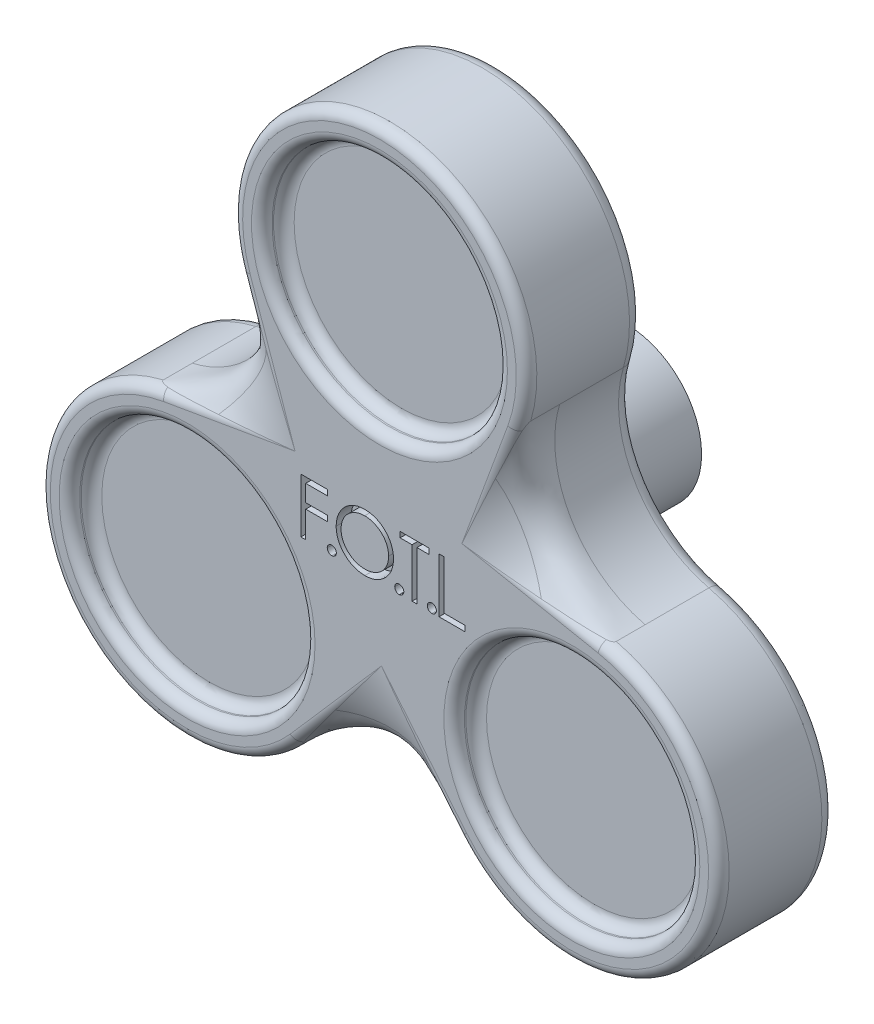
SolidWorks part; units mm, degrees
ref_plane "Front Plane" through (0, 0, 0) normal (0, 0, 1) x (1, 0, 0)
ref_plane "Top Plane" through (0, 0, 0) normal (0, 1, 0) x (1, 0, 0)
ref_plane "Right Plane" through (0, 0, 0) normal (1, 0, 0) x (0, 0, -1)
sketch "Sketch1" plane through (0, 0, 0) normal (0, 0, 1) x (1, 0, 0)
  circle A0 centre (0, 0) radius 2.55
  dimension "D1" = 5.1
extrude "Boss-Extrude1" add sketch "Sketch1" along normal blind 4.4
sketch "Sketch2" plane through (0, 0, 4.4) normal (0, 0, 1) x (1, 0, 0)
  line L0 (-4.7294, 5.9275) -> (-2.412, -0.8275)
  line L1 (4.6925, 5.8236) -> (2.55, 0)
  line L2 (7.4981, 1.1321) -> (0.4894, 2.5026)
  line L3 (2.6972, -6.9756) -> (-1.275, -2.2084)
  line L4 (-2.7686, -7.0595) -> (1.9226, -1.6751)
  line L5 (-7.3897, 1.152) -> (-1.275, 2.2084)
  arc A0 (-10.8686, -6.275) -> (10.8686, -6.275) centre (0, 0) ccw construction
  circle A1 centre (0, 0) radius 2.55 construction
  circle A2 centre (0, 0) radius 2.55
  arc A3 (4.6925, 5.8236) -> (-4.7294, 5.9275) centre (0, 7.55) ccw
  arc A4 (2.6972, -6.9756) -> (7.4981, 1.1321) centre (6.5385, -3.775) ccw
  arc A5 (-7.3897, 1.152) -> (-2.7686, -7.0595) centre (-6.5385, -3.775) ccw
  arc A6 (0, 12.55) -> (-10.8686, -6.275) centre (0, 0) ccw construction
  arc A7 (10.8686, -6.275) -> (0, 12.55) centre (0, 0) ccw construction
  point P24 (0, 0)
  dimension "D1" = 10
  dimension "D2" = 10
  dimension "D3" = 3
extrude "Boss-Extrude2" add sketch "Sketch2" along normal blind 4 contours L3 A4 L2 L1 L4 M2 | L1 L2 M2 | L5 L0 M2 | M2 | L3 L4 M2 | L5 A5 L4 L3 L0 M2 | L1 A3 L0 L5 L2 M2
sketch "Sketch3" plane through (0, 0, 8.4) normal (0, 0, 1) x (1, 0, 0)
  circle A0 centre (0, 7.55) radius 4
  circle A1 centre (6.5385, -3.775) radius 4
  circle A2 centre (-6.5385, -3.775) radius 4
  arc A3 (4.6925, 5.8236) -> (-4.7294, 5.9275) centre (0, 7.55) ccw construction
  dimension "D1" = 1
extrude "Cut-Extrude1" cut sketch "Sketch3" against normal blind 0.75
fillet "Fillet1" radius 0.35 15 edges at (4, 7.55, 7.65) (4, 7.55, 8.4) (1.3791, -5.3937, 8.4) (5.3843, 1.5454, 8.4) (-5.3606, 1.5025, 8.4) (-1.3538, -5.4357, 8.4) (3.9816, 3.8912, 8.4) (-4.0305, 3.8903, 8.4) (10.8408, -6.3226, 8.4) (-10.8959, -6.2271, 8.4) (0.0551, 12.5497, 8.4) (-2.5385, -3.775, 7.65) (-2.5385, -3.775, 8.4) (10.5385, -3.775, 7.65) (10.5385, -3.775, 8.4)
fillet "Fillet2" radius 4 6 edges at (3.1329, 1.8812, 8.2975) (3.2706, 1.9587, 6.225) (-3.1956, 1.7725, 8.2975) (0.0627, -3.6537, 8.2975) (-3.3316, 1.8531, 6.225) (0.061, -3.8118, 6.225)
fillet "Fillet3" radius 0.5 7 edges at (5.1611, 2.9798, 4.4) (10.8686, -6.275, 4.4) (0, -5.9595, 4.4) (-10.8686, -6.275, 4.4) (-5.1611, 2.9798, 4.4) (0, 12.55, 4.4) (2.55, 0, 4.4)
sketch "Sketch5" plane through (0, 0, 8.4) normal (0, 0, 1) x (1, 0, 0)
  line L0 (-2.9098, -0.847) -> (2.8429, -0.847) construction
  line L1 (-2.8673, 1.5781) -> (2.8003, 1.5781) construction
  line L2 (0.067, -3.2722) -> (-2.9098, -3.2722) construction
  line L3 (-0.0335, 1.5781) -> (-0.0335, -3.2722) construction
  text T0 "F.O.T.L" font "Century Gothic" height in points 7
  point P11 (-0.0335, -0.847)
  point P13 (-0.0335, -0.847)
extrude "Cut-Extrude2" cut sketch "Sketch5" against normal blind 0.5
